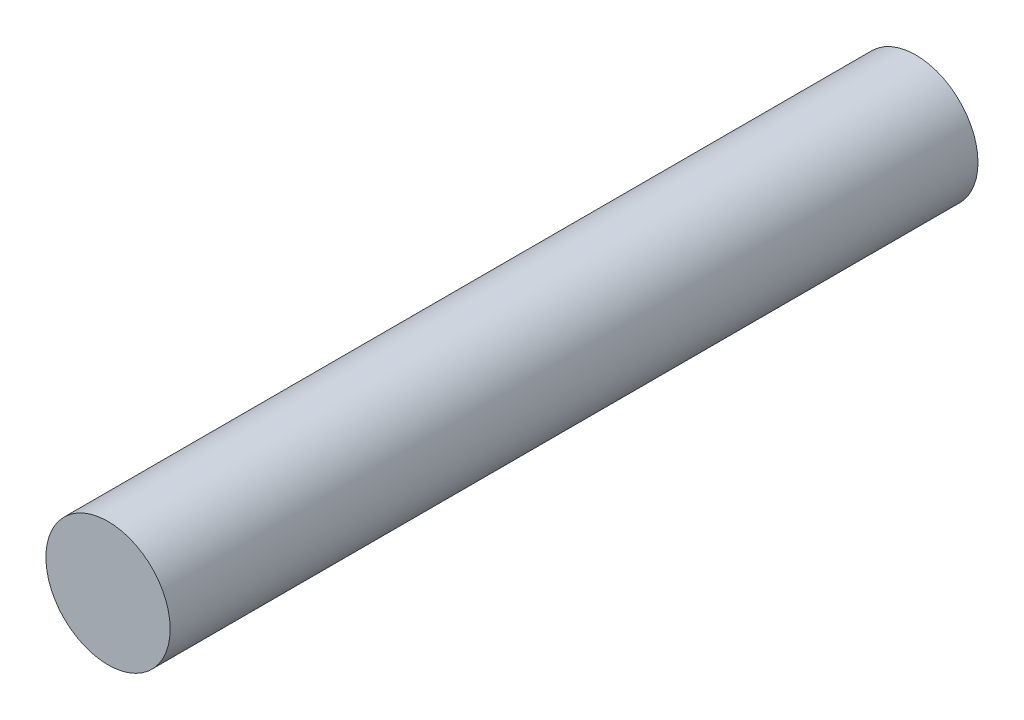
SolidWorks part; units mm, degrees
ref_plane "Alzado" through (0, 0, 0) normal (0, 0, 1) x (1, 0, 0)
ref_plane "Planta" through (0, 0, 0) normal (0, 1, 0) x (1, 0, 0)
ref_plane "Vista lateral" through (0, 0, 0) normal (1, 0, 0) x (0, 0, -1)
sketch "Croquis1" plane through (0, 0, 0) normal (0, 1, 0) x (1, 0, 0)
  line L0 (2.5, 0) -> (0, 0)
  line L1 (0, 0) -> (0, -32.5)
  line L2 (0, -32.5) -> (2.5, -32.5)
  line L3 (2.5, -32.5) -> (2.5, 0)
  line L4 (0, -4.5833) -> (0, -115.2359) construction
  point P3 (0, 0)
  point P4 (0, 0)
  point P11 (0, 0)
  dimension "D1" = 32.5
  dimension "D2" = 2.5
revolve "Revolución1" add sketch "Croquis1" angle 360 about L4
